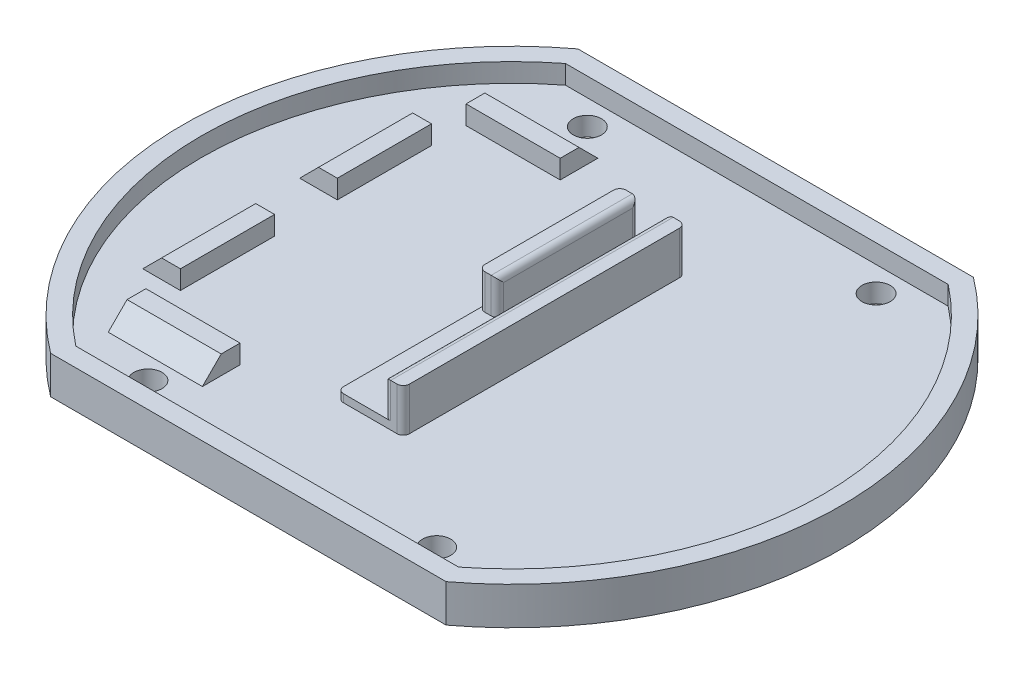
SolidWorks part; units mm, degrees
other "<a_base_t42>-<#8 Clearance Hole1>"
ref_plane "Front Plane" through (0, 0, 0) normal (0, 0, 1) x (1, 0, 0)
ref_plane "Top Plane" through (0, 0, 0) normal (0, 1, 0) x (1, 0, 0)
ref_plane "Right Plane" through (0, 0, 0) normal (1, 0, 0) x (0, 0, -1)
inserted part "a_base_t42"
sketch "Sketch1" plane through (0, 3, 0) normal (0, 1, 0) x (1, 0, 0)
  line L1 (30.4836, 39) -> (-30.4836, 39)
  line L2 (-30.4836, -39) -> (30.4836, -39)
  line L3 (-31.5, -42) -> (31.5, -42)
  line L4 (31.5, 42) -> (-31.5, 42)
  line L5 (-31.5, -42) -> (31.5, -42)
  line L6 (31.5, 42) -> (-31.5, 42)
  arc A0 (-30.4836, 39) -> (-30.4836, -39) centre (0, 0) ccw
  arc A1 (30.4836, -39) -> (30.4836, 39) centre (0, 0) ccw
  arc A2 (31.5, -42) -> (31.5, 42) centre (0, 0) ccw
  arc A3 (-31.5, 42) -> (-31.5, -42) centre (0, 0) ccw
  arc A4 (31.5, -42) -> (31.5, 42) centre (0, 0) ccw
  arc A5 (-31.5, 42) -> (-31.5, -42) centre (0, 0) ccw
  dimension "D1" = 0
  dimension "D2" = 3
extrude "Outer Brim" add sketch "Sketch1" along normal blind 3
sketch "Sketch5" plane through (0, 3, 0) normal (0, 1, 0) x (1, 0, 0)
  line L0 (0, 39) -> (0, 0) construction
  line L1 (-35.825, -20) -> (-35.825, -5)
  line L2 (-32.825, 20) -> (-35.825, 20)
  line L3 (30.4836, 39) -> (-30.4836, 39) construction
  line L4 (0, 0) -> (49.5, 0) construction
  line L5 (-32.825, -28.5) -> (-32.825, -25.5)
  line L6 (-32.825, 28.5) -> (-17.825, 28.5)
  line L7 (-32.825, 28.5) -> (-32.825, 25.5)
  line L8 (-32.825, 25.5) -> (-17.825, 25.5)
  line L9 (-17.825, 28.5) -> (-17.825, 25.5)
  line L10 (-32.825, -25.5) -> (-17.825, -25.5)
  line L11 (-17.825, -28.5) -> (-17.825, -25.5)
  line L12 (-32.825, -28.5) -> (-17.825, -28.5)
  line L13 (-32.825, 20) -> (-32.825, 5)
  line L14 (-32.825, 5) -> (-35.825, 5)
  line L15 (-35.825, 20) -> (-35.825, 5)
  line L16 (-32.825, -5) -> (-35.825, -5)
  line L17 (-32.825, -20) -> (-32.825, -5)
  line L18 (-32.825, -20) -> (-35.825, -20)
  arc A0 (30.4836, -39) -> (30.4836, 39) centre (0, 0) ccw construction
  point P17 (11.425, 0)
  dimension "D1" = 25.5
  dimension "D2" = 15
  dimension "D3" = 3
  dimension "D4" = 11.425
  dimension "D5" = 44.25
  dimension "D6" = 10
extrude "Base Supports" add sketch "Sketch5" along normal up to surface (3 mm away)
chamfer "Base Supports Chamfer" distance 3 angle 45 4 edges at (-25.325, 3, 28.5) (-25.325, 3, -28.5) (-35.825, 3, 12.5) (-35.825, 3, -12.5)
sketch "Sketch6" plane through (0, 3, 0) normal (0, 1, 0) x (1, 0, 0)
  circle A0 centre (-40.25, 0) radius 1 construction
  circle A1 centre (40.25, 0) radius 1 construction
  circle A2 centre (-40.25, 0) radius 1
  circle A3 centre (40.25, 0) radius 1
extrude "Cover" add sketch "Sketch6" against normal up to surface (3 mm away)
ref_point "Point1"
sketch "Sketch2" plane through (0, 3, 0) normal (0, 1, 0) x (1, 0, 0)
  line L0 (0, 39) -> (0, 0) construction
  line L1 (30.4836, 39) -> (-30.4836, 39) construction
  line L2 (0, 0) -> (-49.5, 0) construction
  line L3 (5.175, 22.5) -> (5.175, -22.5)
  line L4 (-17.825, 25.5) -> (-17.825, 31.5) construction
  line L8 (5.175, -22.5) -> (-5.325, -22.5)
  line L9 (-5.325, 22.5) -> (-5.325, -22.5)
  line L10 (5.175, 22.5) -> (-5.325, 22.5)
  arc A0 (-30.4836, 39) -> (-30.4836, -39) centre (0, 0) ccw construction
  dimension "D1" = 10.5
  dimension "D2" = 45
  dimension "D3" = 12.5
extrude "Dynamixel Offset" add sketch "Sketch2" along normal blind 1.25
sketch "Sketch3" plane through (0, 4.25, 0) normal (0, 1, 0) x (1, 0, 0)
  line L10 (-5.325, 22.5) -> (-5.325, -22.5) construction
  line L11 (-5.325, 0) -> (-2.325, 0)
  line L12 (-5.325, 0) -> (-5.325, 22.5)
  line L13 (-5.325, 22.5) -> (-2.325, 22.5)
  line L14 (-2.325, 0) -> (-2.325, 22.5)
  line L15 (5.175, 22.5) -> (-5.325, 22.5) construction
  line L16 (-5.325, -22.5) -> (5.175, -22.5) construction
  line L17 (5.175, 22.5) -> (2.175, 22.5)
  line L18 (5.175, 22.5) -> (5.175, -22.5)
  line L19 (5.175, -22.5) -> (2.175, -22.5)
  line L20 (2.175, 22.5) -> (2.175, -22.5)
  dimension "D1" = 3
extrude "Dynamixel Side Support Walls" add sketch "Sketch3" along normal blind 5.6
fillet "Dynamixel Support Contouring" radius 1 11 edges at (5.175, 6.425, -22.5) (-5.325, 6.425, -22.5) (5.175, 6.425, 22.5) (-5.325, 3.625, 22.5) (2.175, 9.85, 0) (-2.325, 9.85, -11.25) (2.175, 7.05, 22.5) (-2.325, 7.05, 0) (2.175, 7.05, -22.5)
sketch "Sketch7" [suppressed] plane through (0, 3, 0) normal (0, 1, 0) x (1, 0, 0)
  line L0 (0, 39) -> (0, 0) construction
  line L1 (30.4836, 39) -> (-30.4836, 39) construction
  line L2 (0, 0) -> (-49.5, 0) construction
  line L3 (-17.825, 25.5) -> (-17.825, 31.5) construction
  line L4 (-0.075, 27.82) -> (4.925, 27.82)
  line L5 (-0.075, 27.82) -> (-0.075, -27.82)
  line L6 (-0.075, -27.82) -> (4.925, -27.82)
  line L7 (4.925, 27.82) -> (4.925, -27.82)
  arc A0 (-30.4836, 39) -> (-30.4836, -39) centre (0, 0) ccw construction
  dimension "D1" = 5
  dimension "D2" = 17.75
  dimension "D3" = 55.64
extrude "Servo Side Supports" [suppressed] add sketch "Sketch7" along normal blind 8.5
sketch "Sketch8" [suppressed] plane through (0, 11.5, 0) normal (0, 1, 0) x (1, 0, 0)
  line L0 (4.925, -27.82) -> (4.925, 27.82) construction
  line L1 (-0.075, 27.82) -> (4.925, 27.82)
  line L2 (-0.075, 27.82) -> (-0.075, 20)
  line L3 (-0.075, 20) -> (4.925, 20)
  line L4 (4.925, 27.82) -> (4.925, 20)
  line L5 (-71.1896, 0) -> (0, 0) construction
  line L6 (0, 0) -> (0, 70.1513) construction
  line L15 (4.925, -27.82) -> (4.925, -20)
  line L16 (-0.075, -20) -> (4.925, -20)
  line L17 (-0.075, -27.82) -> (-0.075, -20)
  line L18 (-0.075, -27.82) -> (4.925, -27.82)
  dimension "D1" = 40
extrude "Servo Side Extensions" [suppressed] add sketch "Sketch8" along normal blind 5
fillet "Servo Contouring" [suppressed] radius 1
equation "\"D2@Sketch1\"=\"width keep@values@params_print.sldprt\""
equation "\"D1@Outer Brim\"=\"width keep@values@params_print.sldprt\""
equation "\"D1@Sketch2\"=4.5+2*\"width keep@values@params_print.sldprt\""
equation "\"D1@Sketch3\"=\"width keep@values@params_print.sldprt\""
equation "\"D3@Sketch5\"=\"width keep@values@params_print.sldprt\""
equation "\"D1@Base Supports Chamfer\"=\"width keep@values@params_print.sldprt\""
equation "\"D4@Sketch5\"=19.425-\"Rp@values@params_finger_t42.sldprt\""
